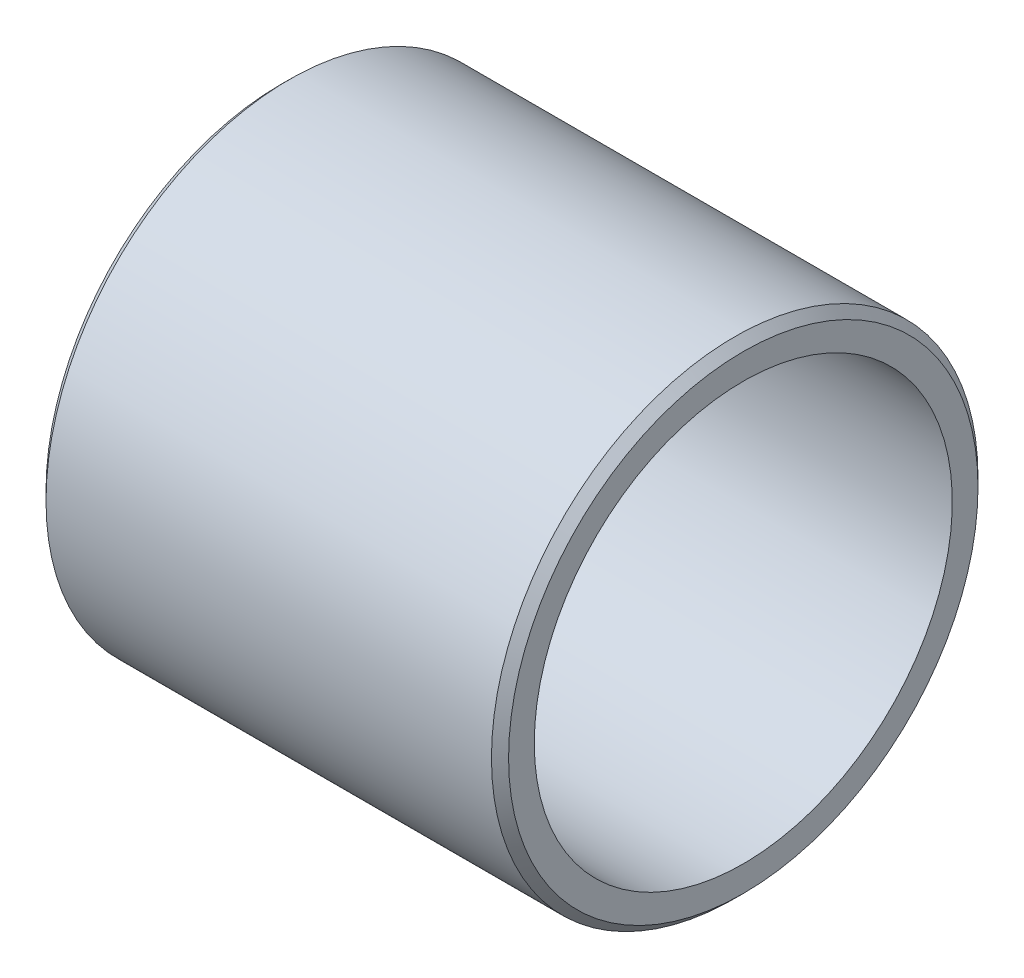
SolidWorks part; units mm, degrees
ref_plane "Plan1" through (0, 0, 0) normal (0, 0, 1) x (1, 0, 0)
ref_plane "Plan2" through (0, 0, 0) normal (0, 1, 0) x (1, 0, 0)
ref_plane "Plan3" through (0, 0, 0) normal (1, 0, 0) x (0, 0, -1)
sketch "Esquisse1" plane through (0, 0, 0) normal (0, 0, 1) x (1, 0, 0)
  line L0 (0, 0) -> (20, 0) construction
  line L1 (-13.5, 14.2) -> (13.5, 14.2)
  point P5 (0, 14.2)
  dimension "D1" = 14.2
  dimension "D2" = 27
revolve "Base-Révol.-Mince" add sketch "Esquisse1" angle 360 about L0
chamfer "Chanfrein1" distance 0.5 angle 45
